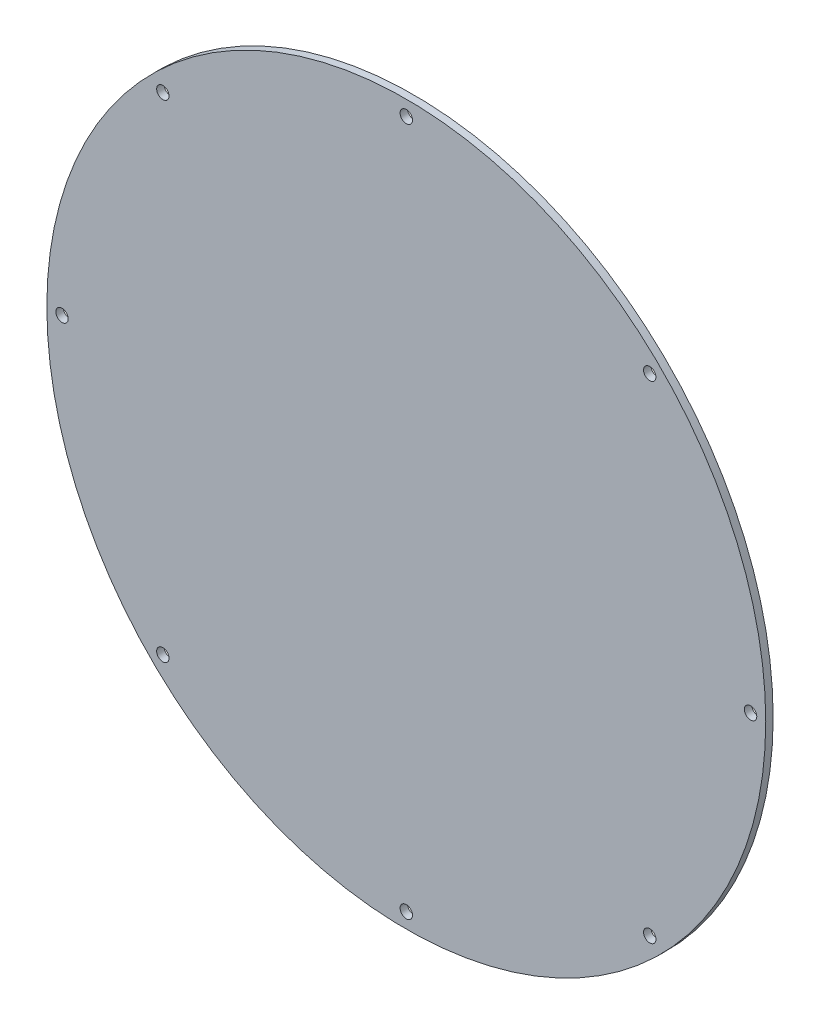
SolidWorks part; units mm, degrees
ref_plane "Front Plane" through (0, 0, 0) normal (0, 0, 1) x (1, 0, 0)
ref_plane "Top Plane" through (0, 0, 0) normal (0, 1, 0) x (1, 0, 0)
ref_plane "Right Plane" through (0, 0, 0) normal (1, 0, 0) x (0, 0, -1)
sketch "Sketch1" plane through (0, 0, 0) normal (0, 0, 1) x (1, 0, 0)
  line L0 (0, 171.1208) -> (0, -171.1208) construction
  line L1 (-174.4216, 0) -> (182.7605, 0) construction
  circle A0 centre (0, 0) radius 154
  circle A1 centre (0, 0) radius 147.5 construction
  dimension "D1" = 308
  dimension "D2" = 295
extrude "Boss-Extrude1" add sketch "Sketch1" along normal blind 3.175
sketch "Sketch2" plane through (0, 0, 0) normal (0, 0, -1) x (-1, 0, 0)
  line L0 (0, 171.1208) -> (0, -171.1208) construction
  circle A0 centre (0, 147.5) radius 1.8288
  circle A1 centre (0, 0) radius 147.5 construction
  dimension "D1" = 3.6576
extrude "Cut-Extrude1" [suppressed] cut sketch "Sketch2" against normal blind 2.54
pattern_circular "CirPattern1" [suppressed] count 6 over 360
sketch "Sketch3" plane through (0, 0, 3.175) normal (0, 0, 1) x (1, 0, 0)
  line L0 (-175.0466, 0) -> (197.5056, 0) construction
  line L1 (0, 169.1017) -> (0, -172.4988) construction
  line L2 (180.0747, 0) -> (-180.0747, 0) construction
  circle A0 centre (0, 0) radius 147.5 construction
  circle A1 centre (0, 0) radius 150 construction
  circle A2 centre (147.5, 0) radius 2
  point P7 (147.5, 0)
  dimension "D2" = 300
  dimension "D3" = 4
  dimension "D1" = 90
hole_wizard "M5 Clearance Hole1" positions "3DSketch9" profile "Sketch14" hole size "M5" standard "Ansi Metric"
sketch3d "3DSketch9"
  point P0 (147.5, 0, 3.175)
sketch "Sketch14" plane through (147.5, 0, 3.175) normal (1, 0, 0) x (0, -1, 0)
  line L0 (0, 0) -> (0, 26.9923)
  line L1 (0, 26.9923) -> (2.65, 25.4)
  line L2 (2.65, 25.4) -> (2.65, 0)
  line L5 (2.65, 0) -> (0, 0)
  line L10 (0, 26.9923) -> (-2.65, 25.4) construction
  line L11 (0, -6.35) -> (0, 107.95) construction
  dimension "Hole Dia." = 5.3
  dimension "Hole Depth" = 25.4
  dimension "Drill Angle" = 118
pattern_circular "CirPattern2" count 8 over 360 about axis through (0, 0, 0) along (0, 0, 1) of "M5 Clearance Hole1"
sketch "Sketch15" plane through (0, 0, 3.175) normal (0, 0, 1) x (1, 0, 0)
  circle A0 centre (0, 0) radius 59.6
  dimension "D1" = 119.2
extrude "Cut-Extrude2" [suppressed] cut sketch "Sketch15" against normal blind 10
